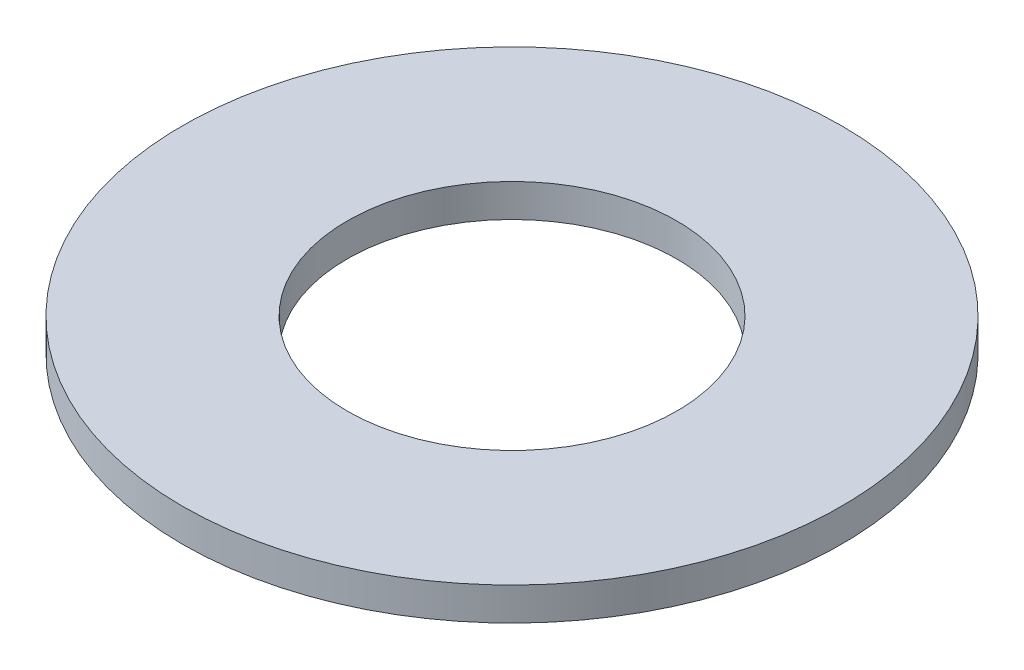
SolidWorks part; units mm, degrees
ref_plane "Front Plane" through (0, 0, 0) normal (0, 0, 1) x (1, 0, 0)
ref_plane "Top Plane" through (0, 0, 0) normal (0, 1, 0) x (1, 0, 0)
ref_plane "Right Plane" through (0, 0, 0) normal (1, 0, 0) x (0, 0, -1)
sketch "Sketch1" plane through (0, 0, 0) normal (0, 1, 0) x (1, 0, 0)
  circle A0 centre (0, 0) radius 25.4
  circle A1 centre (0, 0) radius 12.7
  dimension "D1" = 50.8
  dimension "D2" = 25.4
extrude "Boss-Extrude1" add sketch "Sketch1" along normal blind 2.54 contours A0
